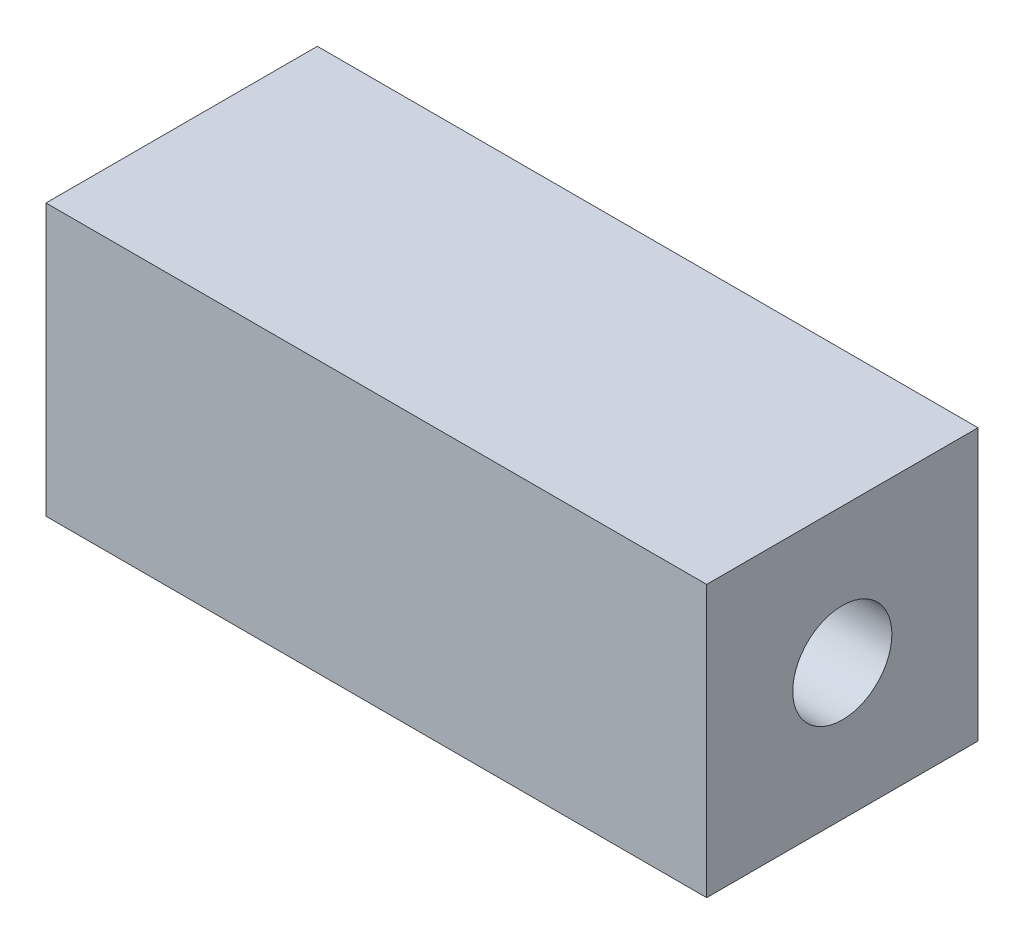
SolidWorks part; units mm, degrees
ref_plane "Спереди" through (0, 0, 0) normal (0, 0, 1) x (1, 0, 0)
ref_plane "Сверху" through (0, 0, 0) normal (0, 1, 0) x (1, 0, 0)
ref_plane "Справа" through (0, 0, 0) normal (1, 0, 0) x (0, 0, -1)
other "Configuration Table"
sketch "Эскиз1" plane through (0, 0, 0) normal (1, 0, 0) x (0, 0, -1)
  line L1 (-11.9614, 4.6852) -> (-0.4614, 4.6852)
  line L2 (-11.9614, 4.6852) -> (-11.9614, -6.8148)
  line L3 (-11.9614, -6.8148) -> (-0.4614, -6.8148)
  line L4 (-0.4614, 4.6852) -> (-0.4614, -6.8148)
  circle A1 centre (-6.2114, -1.0648) radius 2.1
  point P7 (0, 0)
  dimension "D4" = 4.2
  dimension "D1" = 11.5
  dimension "D2" = 11.5
  dimension "D3" = 5.75
extrude "Бобышка-Вытянуть1" add sketch "Эскиз1" along normal blind 28
sketch "Эскиз2" plane through (0, 0, 0) normal (-1, 0, 0) x (0, 0, 1)
  line L0 (2.7499, -3.3403) -> (6.2114, -4.8353)
  line L1 (2.7499, 1.2107) -> (6.2114, 2.7057)
  line L2 (9.6729, 1.2107) -> (9.6729, -3.3403)
  line L3 (6.2114, -4.8353) -> (9.6729, -3.3403)
  line L4 (11.9614, -6.8148) -> (11.9614, 4.6852)
  line L5 (11.9614, 4.6852) -> (0.4614, 4.6852)
  line L6 (0.4614, 4.6852) -> (0.4614, -6.8148)
  line L7 (0.4614, -6.8148) -> (11.9614, -6.8148)
  line L8 (11.9614, -6.8148) -> (11.9614, 4.6852)
  line L9 (11.9614, 4.6852) -> (0.4614, 4.6852)
  line L10 (0.4614, 4.6852) -> (0.4614, -6.8148)
  line L11 (0.4614, -6.8148) -> (11.9614, -6.8148)
  line L12 (6.2114, 2.7057) -> (9.6729, 1.2107)
  line L13 (2.7499, 1.2107) -> (2.7499, -3.3403)
  circle A1 centre (6.2114, -1.0648) radius 3.4615 construction
  circle A3 centre (6.2114, -1.0648) radius 2.1
  point P2 (0, 0)
  point P15 (0, 0)
  dimension "D3" = 6.9229
  dimension "D4" = 6.9229
  dimension "D1" = 0
extrude "Вырез-Вытянуть1" cut sketch "Эскиз2" against normal blind 3.5 contours L1 L13 L0 L3 L2 L12 M18
